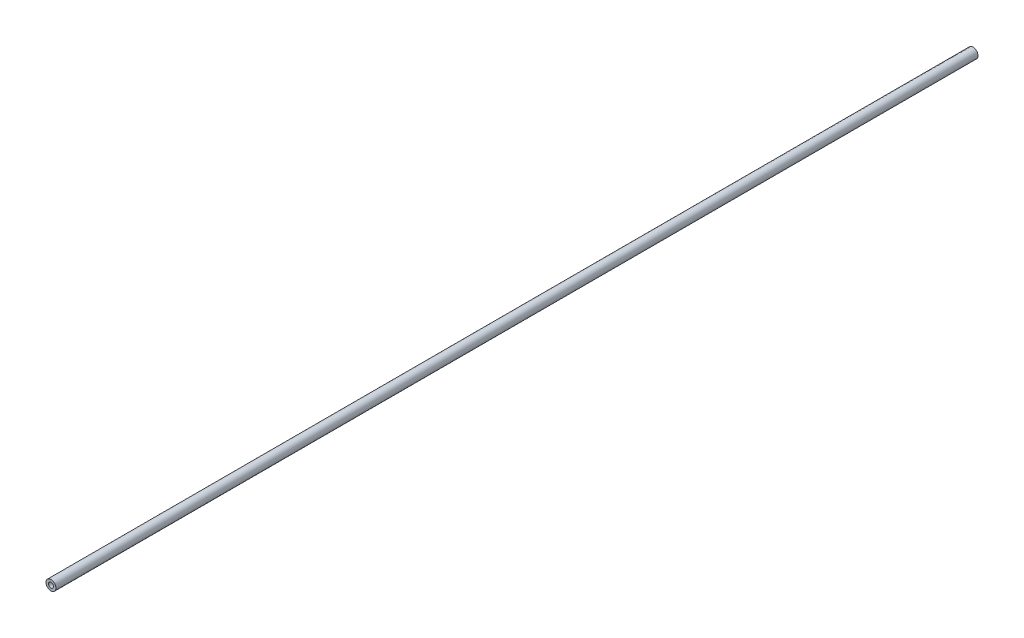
SolidWorks part; units mm, degrees
ref_plane "Plan de face" through (0, 0, 0) normal (0, 0, 1) x (1, 0, 0)
ref_plane "Plan de dessus" through (0, 0, 0) normal (0, 1, 0) x (1, 0, 0)
ref_plane "Plan de droite" through (0, 0, 0) normal (1, 0, 0) x (0, 0, -1)
sketch "Esquisse1" plane through (0, 0, 0) normal (1, 0, 0) x (0, 0, -1)
  line L2 (-463.8, 0) -> (463.8, 0)
  line L3 (-463.8, 0) -> (-463.8, 5)
  line L4 (-463.8, 5) -> (463.8, 5)
  line L5 (463.8, 0) -> (463.8, 5)
  dimension "D1" = 927.6
  dimension "D2" = 5
revolve "Révolution1" add sketch "Esquisse1" angle 360 about L2
hole_wizard "Trou taraudé M61" positions "Esquisse3D1" profile "Esquisse2" tap size "M6" standard "ISO"
sketch3d "Esquisse3D1"
  line L0 (0, 0, -463.8) -> (0, 0, 463.8) construction
  point P0 (0, 0, -463.8)
sketch "Esquisse2" plane through (0, 0, -463.8) normal (1, 0, 0) x (0, 1, 0)
  line L0 (0, 0) -> (0, 18.5022)
  line L1 (0, 18.5022) -> (2.5, 17)
  line L2 (2.5, 17) -> (2.5, 0)
  line L5 (2.5, 0) -> (0, 0)
  line L10 (0, 18.5022) -> (-2.5, 17) construction
  line L11 (0, -6.35) -> (0, 107.95) construction
  dimension "Diamètre du trou pour taraudage" = 5
  dimension "Profondeur du trou pour taraudage" = 17
  dimension "Angle de pointe" = 118
mirror "Symétrie1" about plane through (0, 0, 0) normal (0, 0, 1) of "Trou taraudé M61"
